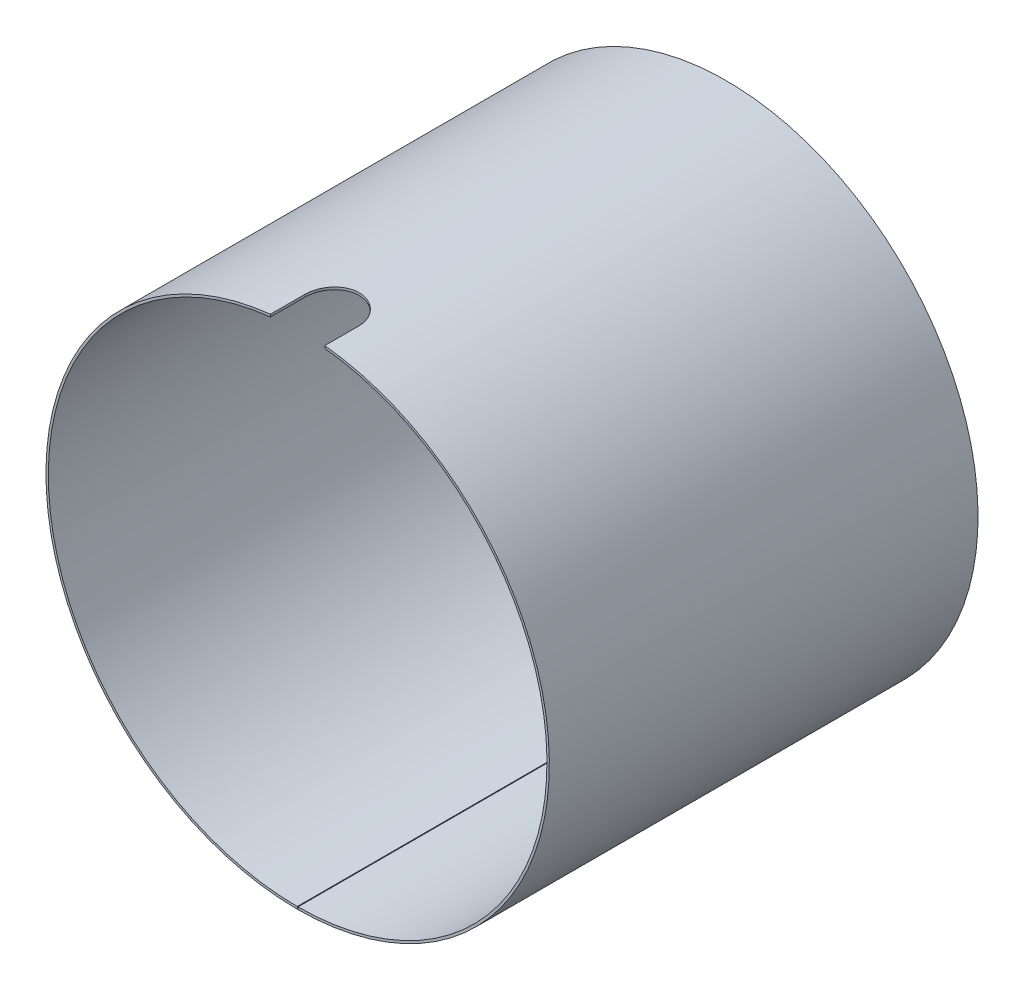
SolidWorks part; units mm, degrees
other "DetailItem1"
ref_plane "Front Plane" through (0, 0, 0) normal (0, 0, 1) x (1, 0, 0)
ref_plane "Top Plane" through (0, 0, 0) normal (0, 1, 0) x (1, 0, 0)
ref_plane "Right Plane" through (0, 0, 0) normal (1, 0, 0) x (0, 0, -1)
sketch "Sketch1" plane through (0, 0, 0) normal (0, 0, 1) x (1, 0, 0)
  line L0 (0, 96.3071) -> (0, -106.6048) construction
  line L1 (-129.0725, 0) -> (142.6468, 0) construction
  circle A0 centre (0, 0) radius 177.8
  dimension "D1" = 355.6
extrude "Extrude-Thin1" add sketch "Sketch1" along normal blind 491.676 thin
sketch "Sketch2" plane through (0, 0, 491.676) normal (0, 0, 1) x (1, 0, 0)
  circle A0 centre (0, 0) radius 165.2 construction
  circle A1 centre (0, 0) radius 177.8 construction
  dimension "D1" = 12.6
sketch "Sketch3" plane through (0, 0, 0) normal (0, 0, -1) x (-1, 0, 0)
  circle A0 centre (0, 0) radius 163.2
  circle A1 centre (0, 0) radius 165.2 construction
  dimension "D1" = 2
extrude "Cut-Extrude1" cut sketch "Sketch3" against normal blind 479.676
sketch "Sketch4" plane through (0, 0, 491.676) normal (0, 0, 1) x (1, 0, 0)
  circle A0 centre (0, 0) radius 166.7748
  circle A1 centre (0, 0) radius 165.2 construction
  dimension "D1" = 1.5748
extrude "Cut-Extrude2" cut sketch "Sketch4" against normal blind 484.676 flip side to cut
sketch "Sketch5" plane through (0, 0, 491.676) normal (0, 0, 1) x (1, 0, 0)
  line L0 (0, -192.0956) -> (0, 189.954) construction
  line L1 (184.8144, 0) -> (-222.077, 0) construction
  line L2 (36.8305, 185.1594) -> (-36.8305, -185.1594) construction
  circle A0 centre (0, 0) radius 158.7748 construction
  circle A1 centre (0, 0) radius 166.7748 construction
  dimension "D1" = 8
  dimension "D2" = 11.25
hole_wizard "M5x0.8 Tapped Hole2" positions "3DSketch1" profile "Sketch6" tap size "M5x0.8" standard "Ansi Metric"
sketch3d "3DSketch1"
  line L1 (36.8305, 185.1594, 491.676) -> (-36.8305, -185.1594, 491.676) construction
  circle A1 centre (0, 0, 491.676) radius 158.7748 construction
  point P8 (30.9754, 155.724, 491.676)
  point P14 (0, 0, 650.4508)
sketch "Sketch6" plane through (30.9754, 155.724, 491.676) normal (1, 0, 0) x (0, -1, 0)
  line L0 (0, 0) -> (0, 491.676)
  line L1 (0, 491.676) -> (2.5, 491.676)
  line L2 (2.5, 491.676) -> (2.5, 0)
  line L5 (2.5, 0) -> (0, 0)
  line L11 (0, -6.35) -> (0, 107.95) construction
  dimension "Thread Major Dia." = 5
  dimension "Thru Tap Drill Depth" = 491.676
sketch "Sketch7" plane through (0, 0, 0) normal (0, 0, -1) x (-1, 0, 0)
  line L0 (0, -192.0956) -> (0, 185.0657) construction
  line L1 (0, -192.0956) -> (0, 189.954) construction
  line L2 (-184.8144, 0) -> (222.077, 0) construction
  line L3 (-196.9689, 0) -> (196.9689, 0) construction
  circle A0 centre (0, 0) radius 172.8 construction
  circle A1 centre (0, 0) radius 177.8 construction
  dimension "D1" = 5
  dimension "D2" = 90
hole_wizard "M5x0.8 Tapped Hole1" positions "3DSketch3" profile "Sketch9" tap size "M5x0.8" standard "Ansi Metric"
sketch3d "3DSketch3"
  line L1 (196.9689, 0, 0) -> (-196.9689, 0, 0) construction
  circle A1 centre (0, 0, 0) radius 172.8 construction
  point P10 (172.8, 0, 0)
  point P16 (0, 0, -172.8)
sketch "Sketch9" plane through (172.8, 0, 0) normal (1, 0, 0) x (0, 1, 0)
  line L0 (0, 0) -> (0, 15.6618)
  line L1 (0, 15.6618) -> (2.1, 14.4)
  line L2 (2.1, 14.4) -> (2.1, 12)
  line L3 (2.1, 12) -> (2.5, 12)
  line L4 (2.5, 12) -> (2.5, 0)
  line L5 (2.5, 0) -> (0, 0)
  line L10 (0, 15.6618) -> (-2.1, 14.4) construction
  line L11 (0, -6.35) -> (0, 107.95) construction
  dimension "Tap Drill Dia." = 4.2
  dimension "Tap Drill Depth" = 14.4
  dimension "Thread Major Dia." = 5
  dimension "Thread Depth" = 12
  dimension "Drill Angle" = 118
pattern_circular "CirPattern2" count 8 over 360 about axis through (0, 0, 0) along (0, 0, 1) of "M5x0.8 Tapped Hole1"
sketch "Sketch10" plane through (0, 0, 0) normal (0, 1, 0) x (1, 0, 0)
  line L0 (0, 17.1341) -> (0, -477.5886) construction
  line L5 (0, -511.676) -> (0, -461.676) construction
  line L6 (-18, -511.676) -> (-18, -461.676)
  line L7 (18, -511.676) -> (18, -461.676)
  line L8 (-166.7748, -491.676) -> (166.7748, -491.676) construction
  arc A2 (-18, -511.676) -> (18, -511.676) centre (0, -511.676) ccw
  arc A3 (18, -461.676) -> (-18, -461.676) centre (0, -461.676) ccw
  point P14 (0, -486.676)
  dimension "D4" = 30
  dimension "D5" = 50
  dimension "D6" = 36
extrude "Cut-Extrude3" cut sketch "Sketch10" along normal blind 200
sketch "Sketch11" plane through (0, 0, 479.676) normal (0, 0, -1) x (-1, 0, 0)
  circle A0 centre (0, 0) radius 165.2
  circle A1 centre (0, 0) radius 163.2 construction
  dimension "D1" = 2
extrude "Cut-Extrude4" cut sketch "Sketch11" along normal up to surface (479.676 mm away)
sketch "Sketch12" [suppressed] plane through (0, 0, 479.676) normal (0, 0, -1) x (-1, 0, 0)
  circle A0 centre (0, 0) radius 260.6831
extrude "Cut-Extrude5" [suppressed] cut sketch "Sketch12" along normal through all
sketch "Sketch13" [suppressed] plane through (0, 0, 491.676) normal (0, 0, 1) x (1, 0, 0)
  circle A0 centre (31.0584, 156.141) radius 2.7051
  circle A1 centre (31.0584, 156.141) radius 2.5 construction
  dimension "D1" = 5.4102
extrude "Cut-Extrude6" [suppressed] cut sketch "Sketch13" against normal blind 6.35
pattern_circular "CirPattern1" count 16 over 360 about axis through (0, 0, 0) along (0, 0, 1) of "M5x0.8 Tapped Hole2", "Cut-Extrude6"
sketch "Sketch14" [suppressed] plane through (0, 0, 479.676) normal (0, 0, -1) x (-1, 0, 0)
  circle A1 centre (0, 0) radius 167.2
  arc A4 (-18, 166.2283) -> (18, 166.2283) centre (0, 0) ccw construction
  circle A5 centre (0, 0) radius 165.6125
  dimension "D1" = 1.5875
extrude "Cut-Extrude7" [suppressed] cut sketch "Sketch14" against normal blind 4.7498
sketch "Sketch15" [suppressed] plane through (0, 0, 7) normal (0, 0, 1) x (1, 0, 0)
  circle A0 centre (0, 8.6599) radius 255.756
extrude "Cut-Extrude8" [suppressed] cut sketch "Sketch15" along normal through all
sketch "Sketch16" [suppressed] plane through (0, 0, 7) normal (0, 0, 1) x (1, 0, 0)
  circle A0 centre (0, 0) radius 165.2 construction
  circle A1 centre (0, 0) radius 165.2
  circle A2 centre (0, 0) radius 166.7875
  dimension "D1" = 1.5875
extrude "Cut-Extrude9" [suppressed] cut sketch "Sketch16" against normal blind 4.7498
sketch "Sketch18" plane through (0, 0, 479.676) normal (0, 0, -1) x (-1, 0, 0)
  circle A0 centre (0, 0) radius 165.2
  arc A1 (-18, 164.2164) -> (18, 164.2164) centre (0, 0) ccw construction
extrude "Cut-Extrude10" cut sketch "Sketch18" against normal blind 4.7498
sketch "Sketch24" plane through (0, 0, 484.4258) normal (0, 0, -1) x (-1, 0, 0)
  circle A0 centre (-32.3093, -30.6623) radius 328.6696
extrude "Cut-Extrude17" cut sketch "Sketch24" against normal through all
sketch "Sketch25" plane through (0, 0, 7) normal (0, 0, 1) x (1, 0, 0)
  circle A0 centre (-34.8978, 30.357) radius 317.033
  circle A1 centre (0, 0) radius 166.7748
  circle A2 centre (0, 0) radius 166.7748 construction
extrude "Cut-Extrude18" cut sketch "Sketch25" against normal blind 4.7498
sketch "Sketch26" plane through (0, 0, 2.2502) normal (0, 0, 1) x (1, 0, 0)
  circle A0 centre (-35.709, -24.9491) radius 464.2803
extrude "Cut-Extrude19" cut sketch "Sketch26" against normal blind 4.7498
sketch "Sketch28" plane through (0, 0, 2.2502) normal (0, 0, -1) x (-1, 0, 0)
  line L0 (0, -25.2553) -> (0, -23.6481) construction
  line L1 (-0.254, -160.1461) -> (0.254, -160.1461)
  line L2 (-0.254, -160.1461) -> (-0.254, -173.9682)
  line L3 (-0.254, -173.9682) -> (0.254, -173.9682)
  line L4 (0.254, -160.1461) -> (0.254, -173.9682)
  line L5 (0, -192.0956) -> (0, 189.954) construction
  line L6 (0, -23.6481) -> (0, -198.8347) construction
  dimension "D1" = 175.1866
  dimension "D2" = 0.254
  dimension "D3" = 0.508
extrude "Cut-Extrude20" cut sketch "Sketch28" against normal up to next
sketch "Sketch23" [suppressed] plane through (0, 0, 0) normal (0, 0, -1) x (-1, 0, 0)
  circle A0 centre (24.5299, 39.7523) radius 300.8847
  circle A1 centre (0, 39.7523) radius 213.0383
sketch "Sketch19" [suppressed] plane through (0, 0, 484.4258) normal (0, 0, -1) x (-1, 0, 0)
  circle A0 centre (0, -7.6689) radius 236.0576
sketch "Sketch29" [suppressed] plane through (0, 0, 479.676) normal (0, 0, -1) x (-1, 0, 0)
  circle A0 centre (0, 0) radius 165.1
  circle A1 centre (0, 0) radius 215.2644
  dimension "D1" = 330.2
extrude "Cut-Extrude21" [suppressed] cut sketch "Sketch29" against normal up to surface (4.7498 mm away)
sketch "Sketch30" plane through (0, 0, 2.2502) normal (0, 0, -1) x (-1, 0, 0)
  line L1 (-289.5229, 416.9427) -> (255.4693, 416.9427)
  line L2 (-289.5229, 416.9427) -> (-289.5229, -296.7285)
  line L3 (-289.5229, -296.7285) -> (255.4693, -296.7285)
  line L4 (255.4693, 416.9427) -> (255.4693, -296.7285)
extrude "Cut-Extrude22" cut sketch "Sketch30" against normal blind 198.12
